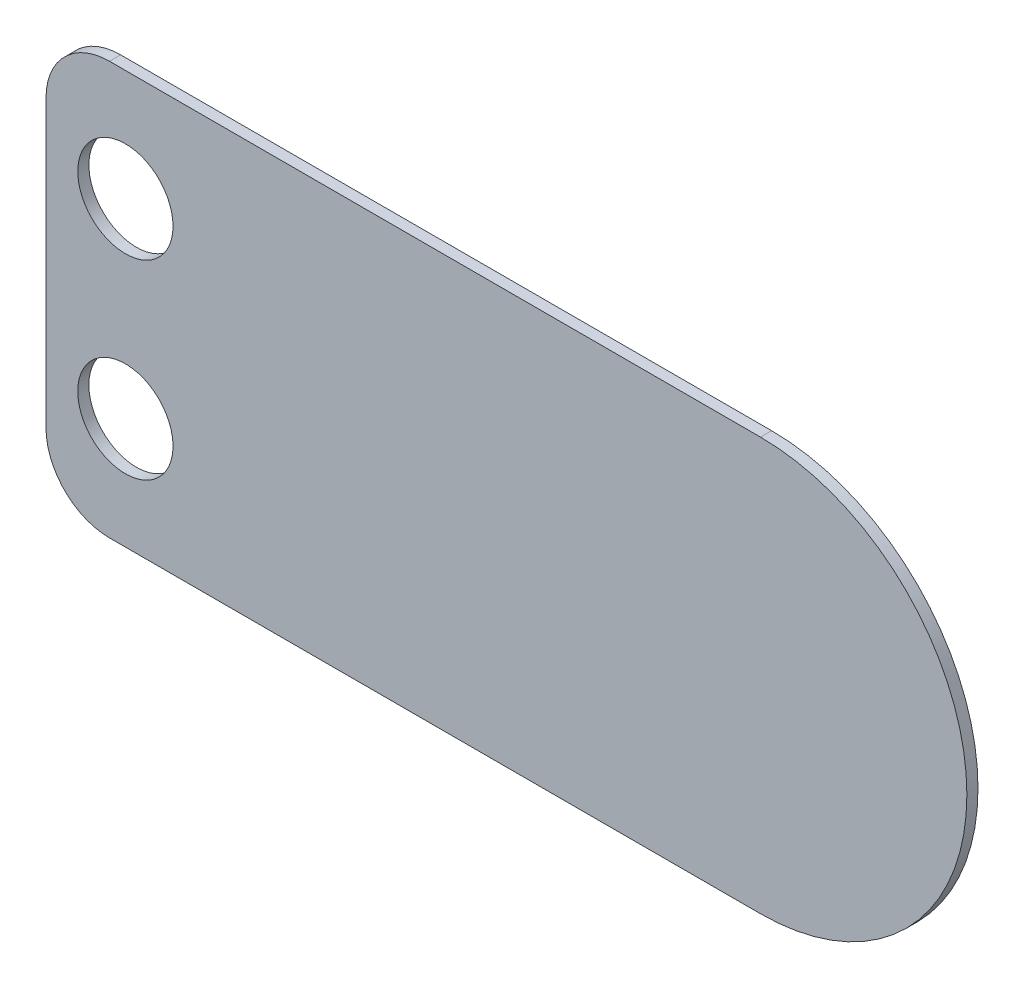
SolidWorks part; units mm, degrees
ref_plane "face" through (0, 0, 0) normal (0, 0, 1) x (1, 0, 0)
ref_plane "dessus" through (0, 0, 0) normal (0, 1, 0) x (1, 0, 0)
ref_plane "profil" through (0, 0, 0) normal (1, 0, 0) x (0, 0, -1)
sketch "Esquisse1" plane through (0, 0, 0) normal (0, 0, 1) x (1, 0, 0)
  line L0 (0, 6.5) -> (-22.5, 6.5)
  line L1 (-22.5, 6.5) -> (-22.5, -6.5)
  line L2 (0, -6.5) -> (-22.5, -6.5)
  line L3 (-28.4194, 0) -> (11.0777, 0) construction
  arc A0 (0, -6.5) -> (0, 6.5) centre (0, 0) ccw
  circle A1 centre (-20, 3) radius 1.5
  circle A2 centre (-20, -3) radius 1.5
  dimension "D1" = 13
  dimension "D3" = 3
  dimension "D4" = 3
  dimension "D2" = 22.5
  dimension "D5" = 20
extrude "Base-Extrusion" add sketch "Esquisse1" along normal blind 0.35
fillet "Congé1" radius 2
